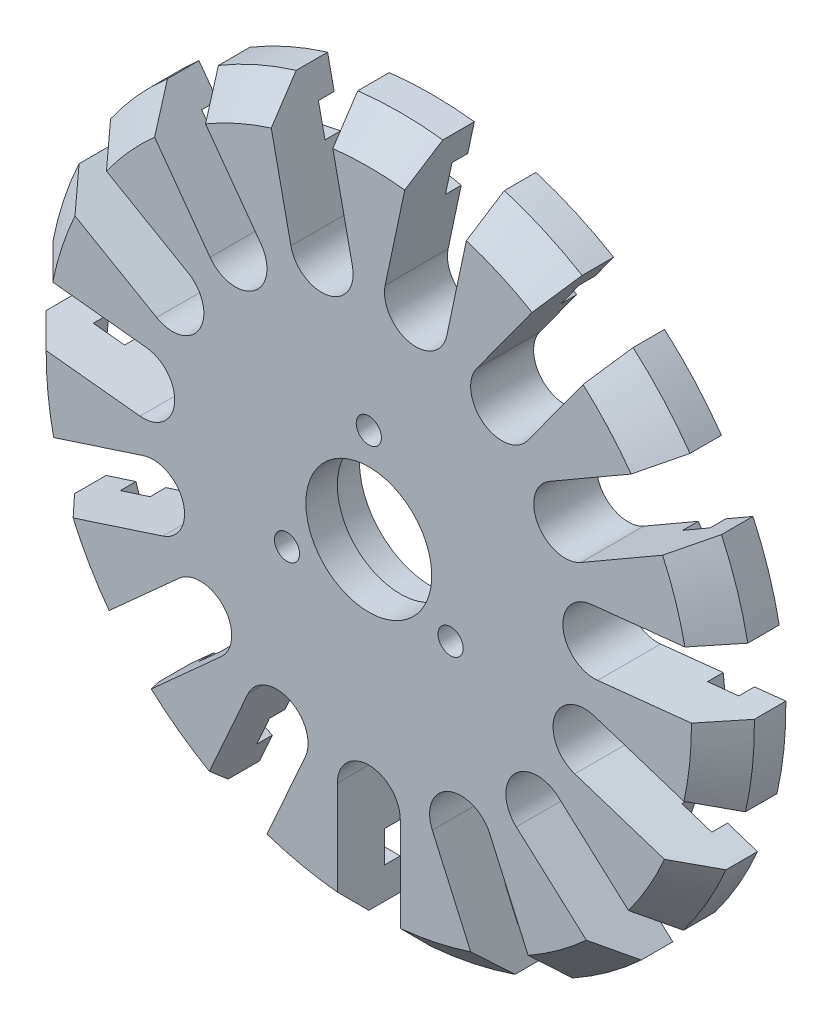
SolidWorks part; units mm, degrees
ref_plane "Plano frontal" through (0, 0, 0) normal (0, 0, 1) x (1, 0, 0)
ref_plane "Plano superior" through (0, 0, 0) normal (0, 1, 0) x (1, 0, 0)
ref_plane "Plano direito" through (0, 0, 0) normal (1, 0, 0) x (0, 0, -1)
sketch "Esboço1" plane through (0, 0, 0) normal (0, 0, 1) x (1, 0, 0)
  circle A0 centre (0, 0) radius 22.5
  dimension "D1" = 45
extrude "Ressalto-extrusão1" add sketch "Esboço1" along normal blind 4
chamfer "Chanfro1" distance 2 angle 45 1 edges at (22.5, 0, 4)
sketch "Esboço2" plane through (0, 0, 0) normal (0, 0, -1) x (-1, 0, 0)
  line L0 (0, 0) -> (0, 14.4289) construction
  line L1 (2, -22.4109) -> (2, -14.4109)
  line L2 (-2, -22.4109) -> (-2, -14.4109)
  arc A0 (-2, -22.4109) -> (2, -22.4109) centre (0, 0) ccw
  circle A1 centre (0, 0) radius 22.5 construction
  arc A2 (2, -14.4109) -> (-2, -14.4109) centre (0, -14.4109) ccw
  dimension "D1" = 4
  dimension "D2" = 8
extrude "Corte-extrusão1" cut sketch "Esboço2" against normal through all
sketch "Esboço3" plane through (0, 0, 0) normal (0, 0, -1) x (-1, 0, 0)
  circle A0 centre (0, 0) radius 4
  dimension "D1" = 8
extrude "Corte-extrusão2" cut sketch "Esboço3" against normal through all
sketch "Esboço4" plane through (0, 0, 0) normal (0, 0, -1) x (-1, 0, 0)
  circle A0 centre (0, 0) radius 4.6
  dimension "D1" = 9.2
extrude "Corte-extrusão3" cut sketch "Esboço4" against normal blind 2
pattern_circular "PadrãoCircular1" count 15 over 360 about axis through (0, 0, 0) along (0, 0, 1) of "Corte-extrusão1"
sketch "Esboço5" plane through (0, 0, 0) normal (0, 0, -1) x (-1, 0, 0)
  circle A0 centre (0, 0) radius 18.5
  circle A1 centre (0, 0) radius 20.5
  dimension "D1" = 41
  dimension "D2" = 37
sketch "Esboço9" plane through (0, 0, 0) normal (0, 0, -1) x (-1, 0, 0)
  line L0 (0, 0) -> (0, 6) construction
  dimension "D1" = 6
hole_wizard "Furo roscado de M21" positions "3DSketch1" profile "Esboço10" tap size "M2" standard "ISO"
sketch3d "3DSketch1"
  point P0 (0, 6, 0)
sketch "Esboço10" plane through (0, 6, 0) normal (1, 0, 0) x (0, 1, 0)
  line L0 (0, 0) -> (0, 4)
  line L1 (0, 4) -> (0.8, 4)
  line L2 (0.8, 4) -> (0.8, 0)
  line L5 (0.8, 0) -> (0, 0)
  line L11 (0, -6.35) -> (0, 107.95) construction
  dimension "Thru Tap Drill Dia." = 1.6
  dimension "Thru Tap Drill Depth" = 4
pattern_circular "PadrãoCircular2" count 3 over 360 about axis through (0, 0, 0) along (0, 0, 1) of "Furo roscado de M21"
sketch "Esboço11" plane through (0, 0, 0) normal (0, 0, -1) x (-1, 0, 0)
  line L0 (0, 0) -> (0, -22.5) construction
  line L1 (2, -22.4109) -> (2, -20.4109) construction
  line L2 (2, -22.4109) -> (2, -14.4109) construction
  line L3 (3.5, -20.4109) -> (-3.5, -20.4109)
  line L4 (-3.5, -20.4109) -> (-3.5, -18.4109)
  line L5 (-3.5, -18.4109) -> (3.5, -18.4109)
  line L6 (3.5, -18.4109) -> (3.5, -20.4109)
  arc A2 (-7.2883, -21.2869) -> (-2, -22.4109) centre (0, 0) ccw construction
  point P13 (0, -20.4109)
  point P16 (0, 0)
  dimension "D1" = 7
  dimension "D2" = 2
  dimension "D3" = 2
extrude "Corte-extrusão4" cut sketch "Esboço11" against normal blind 1
pattern_circular "PadrãoCircular3" count 15 over 360 about axis through (0, 0, 0) along (0, 0, 1) of "Corte-extrusão4"
